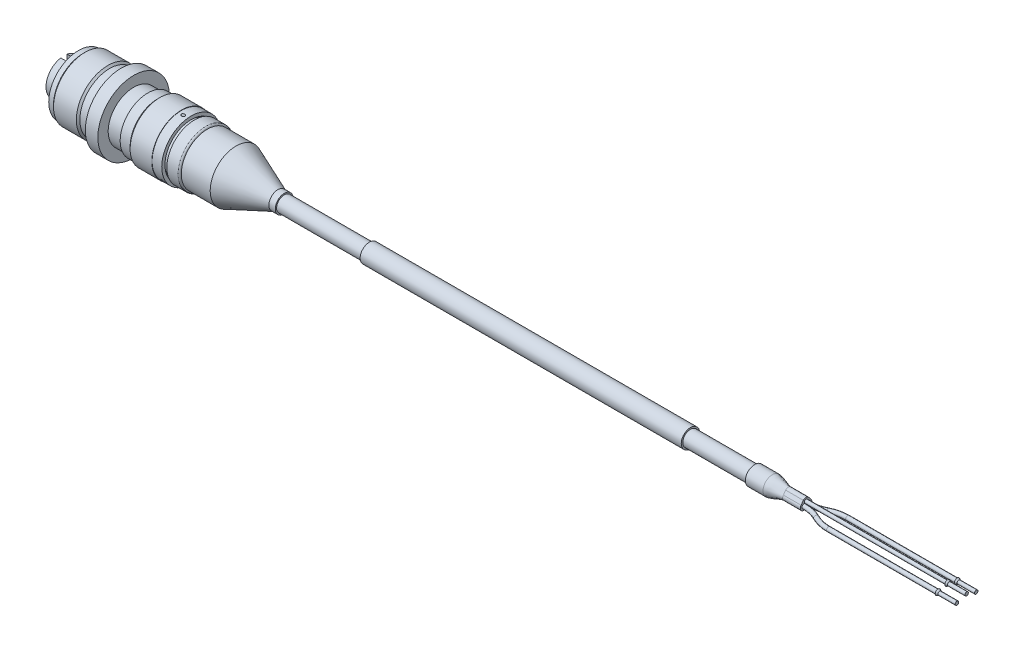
SolidWorks part; units mm, degrees
ref_plane "Plan de face" through (0, 0, 0) normal (0, 0, 1) x (1, 0, 0)
ref_plane "Plan de dessus" through (0, 0, 0) normal (0, 1, 0) x (1, 0, 0)
ref_plane "Plan de droite" through (0, 0, 0) normal (1, 0, 0) x (0, 0, -1)
imported_body "922-319-000-102-K219-957.35.20.3000^922-319-000-002-1-solid1"
imported_body "922-319-000-102-K219-957.35.20.3000^922-319-000-002-1-solid2"
imported_body "922-319-000-102-K219-957.35.20.3000^922-319-000-002-1-solid3"
imported_body "922-319-000-102-K219-957.35.20.3000^922-319-000-002-1-solid4"
imported_body "922-319-000-102-K219-957.35.20.3000^922-319-000-002-1-solid5"
imported_body "922-319-000-102-K219-957.35.20.3000^922-319-000-002-1-solid6"
imported_body "957.11.07.0128-1-solid1"
imported_body "957.11.07.0128-1-solid2"
imported_body "957.12.07.1002^922-319-000-002-1-solid1"
imported_body "957.12.07.1002^922-319-000-002-1-solid2"
imported_body "957.12.07.1002^922-319-000-002-1-solid3"
imported_body "957.12.07.1002^922-319-000-002-1-solid4"
imported_body "957.12.07.1002^922-319-000-002-1-solid5"
imported_body "957.12.07.1002^922-319-000-002-1-solid6"
imported_body "957.12.07.1002^922-319-000-002-1-solid7"
imported_body "957.12.07.7101-1-solid1"
imported_body "957.12.07.7101-2-solid1"
imported_body "957.12.07.7101-3-solid1"
imported_body "957.12.07.7119-1-solid1"
imported_body "957.12.07.7119-2-solid1"
imported_body "dede-957.11.07.0441-1/dede-957.11.07.0441-1-1-solid1"
imported_body "dede-957.11.07.0441-1/dede-957.11.07.0441-2-1-solid1"
imported_body "dede-957.11.07.0441-1/dede-957.11.07.0441-3-1-solid1"
imported_body "dede-957.11.07.0441-1/dede-957.11.07.0441-4-1-solid1"
imported_body "957.19.91.0605^922-319-000-002-1-solid1"
sketch "Esquisse1" plane through (0, 0, 0) normal (0, 0, 1) x (1, 0, 0)
  line L0 (-68.39, 0) -> (155.0505, 0) construction
  line L1 (-39.02, 0) -> (-39.02, 8.3096)
  line L2 (-39.02, 8.05) -> (-39.02, -8.05) construction
  line L3 (-39.02, 8.6) -> (-39.02, -8.6) construction
  line L4 (-39.02, 8.3096) -> (-26.9056, 8.3096)
  line L5 (-26.9056, 8.3096) -> (-26.9056, 6.9657)
  line L6 (-26.9056, -7.35) -> (-26.9056, 7.35) construction
  line L7 (-26.9056, 6.9657) -> (-22.121, 6.9657)
  line L8 (-22.121, 6.9657) -> (-20.5004, 8.085)
  line L9 (-20.5004, 8.085) -> (-11.5004, 8.085)
  line L10 (-11.5004, 8.085) -> (1.4996, 2.8)
  line L11 (1.4996, 2.8) -> (3.4996, 2.8)
  line L12 (3.4996, 2.8) -> (3.4996, 0)
  line L13 (3.4996, 0) -> (-39.02, 0)
  point P9 (0, 0)
  point P23 (-11.0615, 8.085)
  dimension "D1" = 9
  dimension "D2" = 22
  dimension "D3" = 2
  dimension "D4" = 2.8
revolve "Révolution2" add sketch "Esquisse1" angle 360 about L0
sketch "Esquisse2" plane through (3.4996, 0, 0) normal (1, 0, 0) x (0, 0, -1)
  circle A0 centre (0, 0) radius 2.4 construction
  circle A1 centre (0, 0) radius 2.4
extrude "Boss.-Extru.1" add sketch "Esquisse2" along normal up to surface (146.5004 mm away)
sketch "Esquisse3" plane through (166, 0, 0) normal (1, 0, 0) x (0, 0, -1)
  line L3 (1.5614, 0.7013) -> (0.8322, 1.649)
  line L4 (-0.8322, 1.649) -> (-1.5614, 0.7013)
  line L5 (-0.65, -1.15) -> (0.65, -1.15)
  line L6 (1.5614, 0.7013) -> (0.8322, 1.649)
  line L7 (-0.8322, 1.649) -> (-1.5614, 0.7013)
  line L8 (-0.65, -1.15) -> (0.65, -1.15)
  arc A3 (0.65, -1.15) -> (1.5614, 0.7013) centre (0.65, 0) ccw
  arc A4 (0.8322, 1.649) -> (-0.8322, 1.649) centre (0, 1.0087) ccw
  arc A5 (-1.5614, 0.7013) -> (-0.65, -1.15) centre (-0.65, 0) ccw
  arc A6 (0.65, -1.15) -> (1.5614, 0.7013) centre (0.65, 0) ccw
  arc A7 (0.8322, 1.649) -> (-0.8322, 1.649) centre (0, 1.0087) ccw
  arc A8 (-1.5614, 0.7013) -> (-0.65, -1.15) centre (-0.65, 0) ccw
  dimension "D1" = 0
extrude "Boss.-Extru.2" add sketch "Esquisse3" against normal blind 7
sketch "Esquisse4" plane through (216, 0, 0) normal (1, 0, 0) x (0, 0, -1)
  circle A0 centre (0, 1.0087) radius 0.4 construction
  circle A1 centre (3, 0) radius 0.4 construction
  circle A2 centre (-3, 0) radius 0.4 construction
  circle A3 centre (0, 1.0087) radius 0.4
  circle A4 centre (3, 0) radius 0.4
  circle A5 centre (-3, 0) radius 0.4
extrude "Boss.-Extru.3" add sketch "Esquisse4" against normal blind 7
delete or keep bodies "Corps-Supprimer/Garder 1" type delete bodies bodies 105 106 120 119
